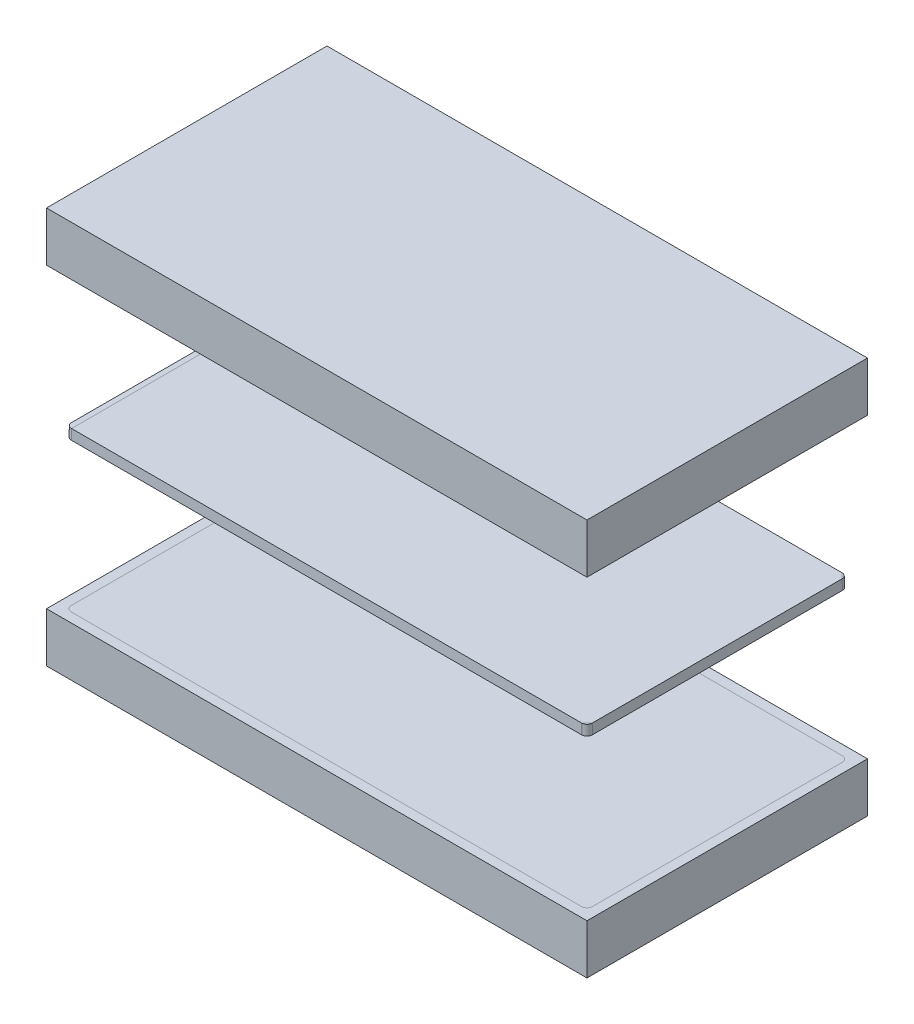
SolidWorks part; units mm, degrees
ref_plane "Front Plane" through (0, 0, 0) normal (0, 0, 1) x (1, 0, 0)
ref_plane "Top Plane" through (0, 0, 0) normal (0, 1, 0) x (1, 0, 0)
ref_plane "Right Plane" through (0, 0, 0) normal (1, 0, 0) x (0, 0, -1)
sketch "Sketch1" plane through (0, 0, 0) normal (0, 1, 0) x (1, 0, 0)
  line L8 (261.1986, 136.3623) -> (-253.303, 136.3623)
  line L9 (266.4478, -120.8885) -> (266.4478, 131.1131)
  line L10 (-253.303, -126.1377) -> (261.1986, -126.1377)
  line L11 (-258.5522, 131.1131) -> (-258.5522, -120.8885)
  line L12 (261.1986, 136.3623) -> (-253.303, 136.3623)
  line L13 (266.4478, -120.8885) -> (266.4478, 131.1131)
  line L14 (-253.303, -126.1377) -> (261.1986, -126.1377)
  line L15 (-258.5522, 131.1131) -> (-258.5522, -120.8885)
  ellipse E4 centre (261.197, 131.1115) end of major axis (264.9104, 134.8249) minor radius 5.25 (266.4478, 131.1131) -> (261.1986, 136.3623) ccw
  ellipse E5 centre (261.197, -120.8869) end of major axis (264.9104, -124.6004) minor radius 5.25 (261.1986, -126.1377) -> (266.4478, -120.8885) ccw
  ellipse E6 centre (-253.3014, -120.8869) end of major axis (-257.0149, -124.6004) minor radius 5.25 (-258.5522, -120.8885) -> (-253.303, -126.1377) ccw
  ellipse E7 centre (-253.3014, 131.1115) end of major axis (-257.0149, 134.8249) minor radius 5.25 (-253.303, 136.3623) -> (-258.5522, 131.1131) ccw
  ellipse E8 centre (261.197, 131.1115) end of major axis (264.9104, 134.8249) minor radius 5.25 (266.4478, 131.1131) -> (261.1986, 136.3623) ccw
  ellipse E9 centre (261.197, -120.8869) end of major axis (264.9104, -124.6004) minor radius 5.25 (261.1986, -126.1377) -> (266.4478, -120.8885) ccw
  ellipse E10 centre (-253.3014, -120.8869) end of major axis (-257.0149, -124.6004) minor radius 5.25 (-258.5522, -120.8885) -> (-253.303, -126.1377) ccw
  ellipse E11 centre (-253.3014, 131.1115) end of major axis (-249.588, 127.398) minor radius 5.25 (-253.303, 136.3623) -> (-258.5522, 131.1131) ccw
  dimension "D1" = 0
extrude "Boss-Extrude1" add sketch "Sketch1" along normal blind 10
draft "Draft1" type of draft neutral plane draft angle 2 faces to draft 8 parameters "D1"=2
other "Parting Line1"
other "Parting Surface1" parameters "D1"=20
sketch "Sketch2" plane through (0, 0, 0) normal (0, -1, 0) x (1, 0, 0)
  line L0 (266.4478, 120.8885) -> (266.4478, -131.1131) construction
  line L1 (276.4478, 136.1377) -> (-268.5522, 136.1377)
  line L2 (276.4478, 136.1377) -> (276.4478, -146.7115)
  line L3 (276.4478, -146.7115) -> (-268.5522, -146.7115)
  line L4 (-268.5522, 136.1377) -> (-268.5522, -146.7115)
  line L5 (-253.303, 126.1377) -> (261.1986, 126.1377) construction
  line L6 (-253.303, -136.7115) -> (261.1986, -136.7115) construction
  line L7 (-258.5522, -131.1131) -> (-258.5522, 120.8885) construction
  dimension "D1" = 10
  dimension "D2" = 10
  dimension "D3" = 10
  dimension "D4" = 10
other "Tooling Split1" parameters "D1"=50, "D2"=50, "D3"=3
move or copy body "Body-Move/Copy1" bodies to move or copy 106 copy no translate (0, -150, 0)
move or copy body "Body-Move/Copy2" bodies to move or copy 107 copy no translate (0, 150, 0)
